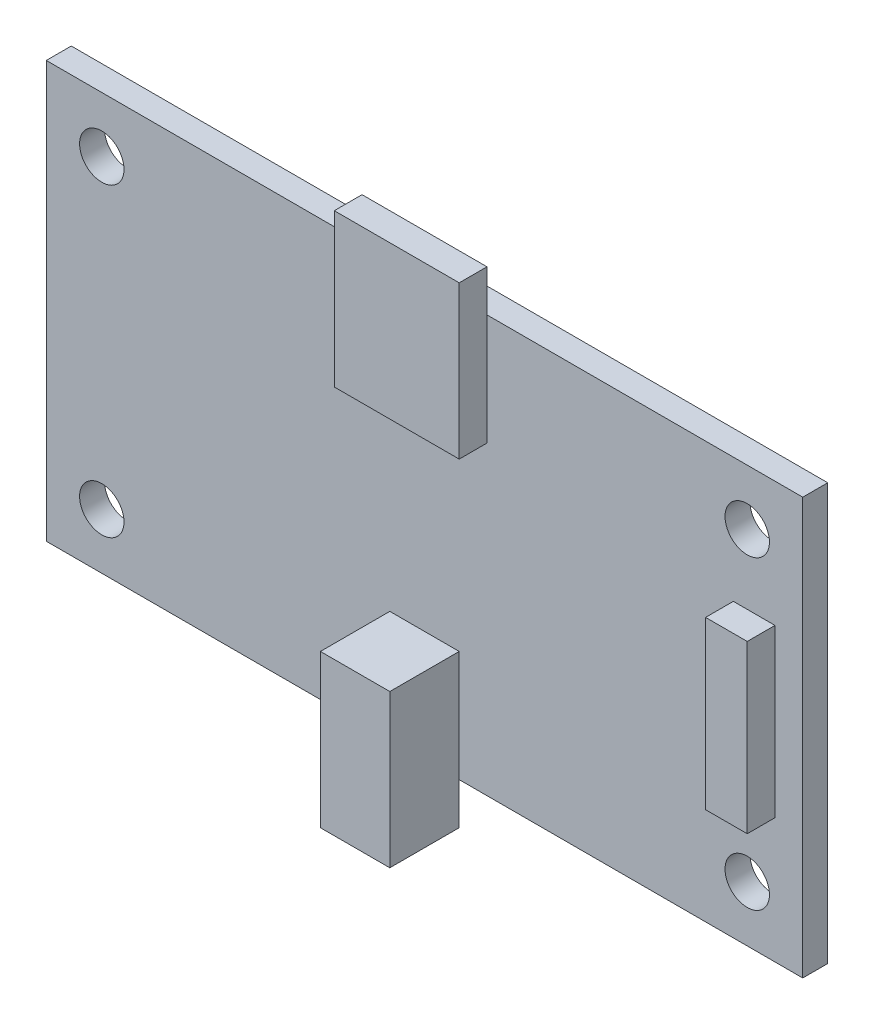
SolidWorks part; units mm, degrees
ref_plane "Plan de face" through (0, 0, 0) normal (0, 0, 1) x (1, 0, 0)
ref_plane "Plan de dessus" through (0, 0, 0) normal (0, 1, 0) x (1, 0, 0)
ref_plane "Plan de droite" through (0, 0, 0) normal (1, 0, 0) x (0, 0, -1)
sketch "Esquisse1" plane through (0, 0, 0) normal (0, 0, 1) x (1, 0, 0)
  line L1 (0, 0) -> (54.5, 0)
  line L2 (0, 0) -> (0, 30)
  line L3 (0, 30) -> (54.5, 30)
  line L4 (54.5, 0) -> (54.5, 30)
  dimension "D1" = 30
  dimension "D2" = 54.5
extrude "Boss.-Extru.1" add sketch "Esquisse1" along normal blind 1.8
sketch "Esquisse2" plane through (0, 0, 1.8) normal (0, 0, 1) x (1, 0, 0)
  line L0 (0, 0) -> (54.5, 0) construction
  line L1 (24.75, 8) -> (29.75, 8)
  line L2 (24.75, 8) -> (24.75, -3)
  line L3 (24.75, -3) -> (29.75, -3)
  line L4 (29.75, 8) -> (29.75, -3)
  line L5 (27.25, 30) -> (27.25, 0) construction
  line L6 (54.5, 30) -> (0, 30) construction
  point P6 (27.25, 8)
  point P7 (27.25, 0)
  point P12 (27.25, 30)
  dimension "D1" = 5
  dimension "D2" = 11
  dimension "D3" = 8
extrude "Boss.-Extru.2" add sketch "Esquisse2" along normal blind 5
sketch "Esquisse3" plane through (0, 0, 1.8) normal (0, 0, 1) x (1, 0, 0)
  line L0 (54.5, 0) -> (54.5, 30) construction
  line L1 (22.75, 33) -> (31.75, 33)
  line L2 (22.75, 33) -> (22.75, 22)
  line L3 (22.75, 22) -> (31.75, 22)
  line L4 (31.75, 33) -> (31.75, 22)
  line L5 (49.5, 21) -> (52.5, 21)
  line L6 (49.5, 21) -> (49.5, 9)
  line L7 (49.5, 9) -> (52.5, 9)
  line L8 (52.5, 21) -> (52.5, 9)
  line L9 (54.5, 30) -> (0, 30) construction
  line L10 (27.25, 30) -> (27.25, 0) construction
  line L11 (54.5, 15) -> (0, 15) construction
  line L12 (0, 30) -> (0, 0) construction
  point P18 (49.5, 15)
  point P19 (27.25, 22)
  dimension "D1" = 3
  dimension "D2" = 12
  dimension "D3" = 5
  dimension "D4" = 11
  dimension "D5" = 9
  dimension "D6" = 8
extrude "Boss.-Extru.3" add sketch "Esquisse3" along normal blind 2
sketch "Esquisse4" plane through (0, 0, 1.8) normal (0, 0, 1) x (1, 0, 0)
  line L0 (29.75, 0) -> (54.5, 0) construction
  line L1 (54.5, 0) -> (54.5, 30) construction
  line L2 (54.5, 30) -> (31.75, 30) construction
  line L3 (22.75, 30) -> (0, 30) construction
  line L4 (0, 30) -> (0, 0) construction
  line L5 (0, 0) -> (24.75, 0) construction
  circle A0 centre (50.5, 26) radius 1.6
  circle A1 centre (50.5, 4) radius 1.6
  circle A2 centre (4, 4) radius 1.6
  circle A3 centre (4, 26) radius 1.6
  dimension "D1" = 3.2
  dimension "D2" = 3.2
  dimension "D3" = 3.2
  dimension "D4" = 3.2
  dimension "D6" = 4
  dimension "D7" = 4
  dimension "D8" = 4
  dimension "D9" = 4
  dimension "D10" = 4
  dimension "D11" = 4
  dimension "D12" = 4
  dimension "D5" = 4
extrude "Enlèv. mat.-Extru.1" cut sketch "Esquisse4" against normal up to next
